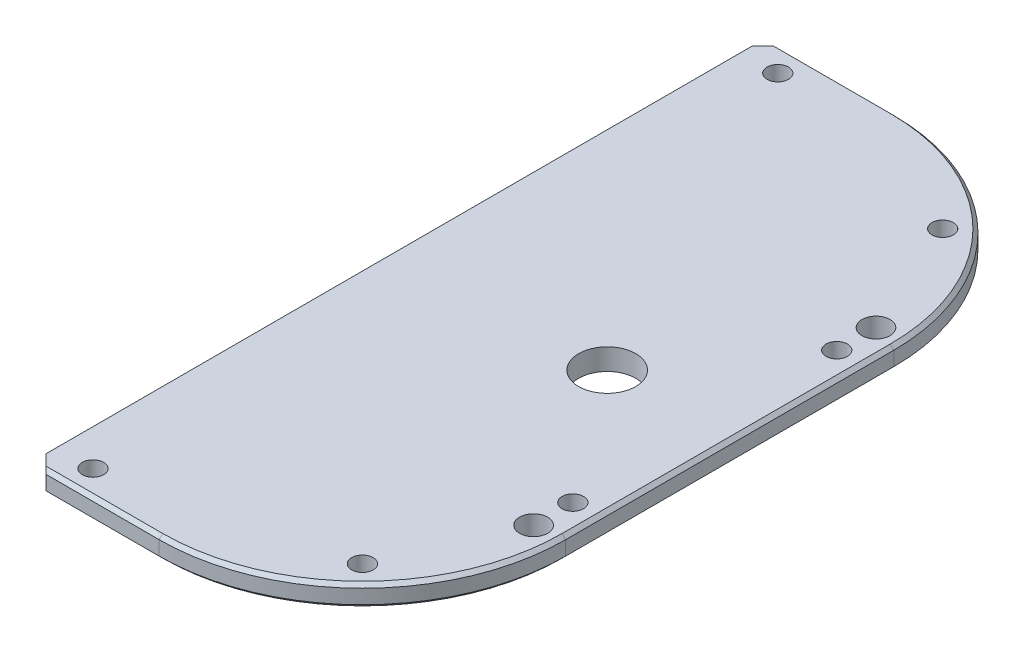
SolidWorks part; units mm, degrees
ref_plane "Front Plane" through (0, 0, 0) normal (0, 0, 1) x (1, 0, 0)
ref_plane "Top Plane" through (0, 0, 0) normal (0, 1, 0) x (1, 0, 0)
ref_plane "Right Plane" through (0, 0, 0) normal (1, 0, 0) x (0, 0, -1)
sketch "Sketch1" plane through (0, 0, 0) normal (0, 1, 0) x (1, 0, 0)
  line L0 (-127, 0) -> (0, 0) construction
  line L1 (-127, 165.1) -> (127, 165.1)
  line L2 (-127, 165.1) -> (-127, -165.1)
  line L3 (-127, -165.1) -> (127, -165.1)
  line L4 (127, 165.1) -> (127, -165.1)
  line L5 (0, 0) -> (0, 165.1) construction
  dimension "D1" = 330.2
  dimension "D2" = 254
extrude "Boss-Extrude1" add sketch "Sketch1" along normal mid plane 9.525
sketch "Sketch3" plane through (0, 4.7625, 0) normal (0, 1, 0) x (1, 0, 0)
  line L0 (-57.5909, 161.925) -> (-114.3, 161.925) construction
  line L1 (-272.0304, -161.925) -> (-57.5909, -161.925) construction
  line L4 (-114.3, -161.925) -> (-114.3, 161.925)
  line L5 (-57.5909, 161.925) -> (-114.3, 161.925)
  line L6 (-114.3, -161.925) -> (-57.5909, -161.925)
  line L8 (31.3091, -73.025) -> (31.3091, 73.025)
  line L9 (-114.3, -142.875) -> (-114.3, -161.925) construction
  arc A0 (31.3091, 73.025) -> (-57.5909, 161.925) centre (-57.5909, 73.025) ccw construction
  arc A10 (31.3091, 73.025) -> (-57.5909, 161.925) centre (-57.5909, 73.025) ccw
  arc A11 (-57.5909, -161.925) -> (31.3091, -73.025) centre (-57.5909, -73.025) ccw
extrude "Cut-Extrude1" cut sketch "Sketch3" against normal through all flip side to cut
sketch "Sketch4" plane through (0, 4.7625, 0) normal (0, 1, 0) x (1, 0, 0)
  circle A0 centre (-21.6463, 0) radius 12.7
  circle A1 centre (-21.6463, 0) radius 20 construction
  dimension "D1" = 25.4
extrude "Cut-Extrude2" cut sketch "Sketch4" against normal through all
fillet "Fillet1" [suppressed] radius 9.525
hole_wizard "Hole1" positions "Sketch6" profile "Sketch5" legacy
sketch "Sketch6" plane through (0, 4.7625, 0) normal (0, 1, 0) x (1, 0, 0)
  circle A0 centre (-98.1356, -152.4) radius 2.5527 construction
  point P0 (-98.1356, -152.4)
  point P3 (-1.4643, -129.1516)
  point P6 (21.7841, -58.7375)
  point P9 (21.7841, 58.7375)
  point P12 (-1.4643, 129.1516)
  point P15 (-98.1356, 152.4)
sketch "Sketch5" plane through (-98.1356, 4.7625, 152.4) normal (1, 0, 0) x (0, 0, 1)
  line L0 (0, 0) -> (0, 88.9)
  line L1 (0, 88.9) -> (4.7625, 88.9)
  line L2 (4.7625, 88.9) -> (4.7625, 0)
  line L3 (4.7625, 0) -> (0, 0)
  line L4 (0, 110) -> (0, -10) construction
  dimension "Diameter" = 9.525
  dimension "Depth" = 88.9
chamfer "Chamfer1" [suppressed] distance 1.5875 angle 45
other "Move Face1" parameters "D1"=1.5875
chamfer "Chamfer2" distance 1.5875 angle 45 10 edges at (-85.9454, -4.7625, 163.5125) (6.3934, -4.7625, 137.0093) (32.8966, -4.7625, 0) (6.3934, -4.7625, -137.0093) (-85.9454, -4.7625, -163.5125) (-85.9454, 4.7625, 163.5125) (6.3934, 4.7625, 137.0093) (32.8966, 4.7625, 0) (6.3934, 4.7625, -137.0093) (-85.9454, 4.7625, -163.5125)
hole_wizard "M12 Clearance Hole1" positions "Sketch8" profile "Sketch7" hole size "M12" standard "ANSI Metric"
sketch "Sketch8" plane through (0, 4.7625, 0) normal (0, 1, 0) x (1, 0, 0)
  circle A0 centre (21.7841, 76.2) radius 3.302 construction
  circle A1 centre (21.7841, -76.2) radius 3.302 construction
  point P0 (21.7841, 76.2)
  point P1 (21.7841, -76.2)
sketch "Sketch7" plane through (21.7841, 4.7625, -76.2) normal (1, 0, 0) x (0, 0, 1)
  line L0 (0, 0) -> (0, 9.525)
  line L1 (0, 9.525) -> (6.25, 9.525)
  line L2 (6.25, 9.525) -> (6.25, 0)
  line L5 (6.25, 0) -> (0, 0)
  line L11 (0, -6.35) -> (0, 107.95) construction
  dimension "Thru Hole Dia." = 12.5
  dimension "Thru Hole Depth" = 9.525
chamfer "Chamfer3" distance 6.35 angle 45 2 edges at (-114.3, 0, 163.5125) (-114.3, 0, -163.5125)
